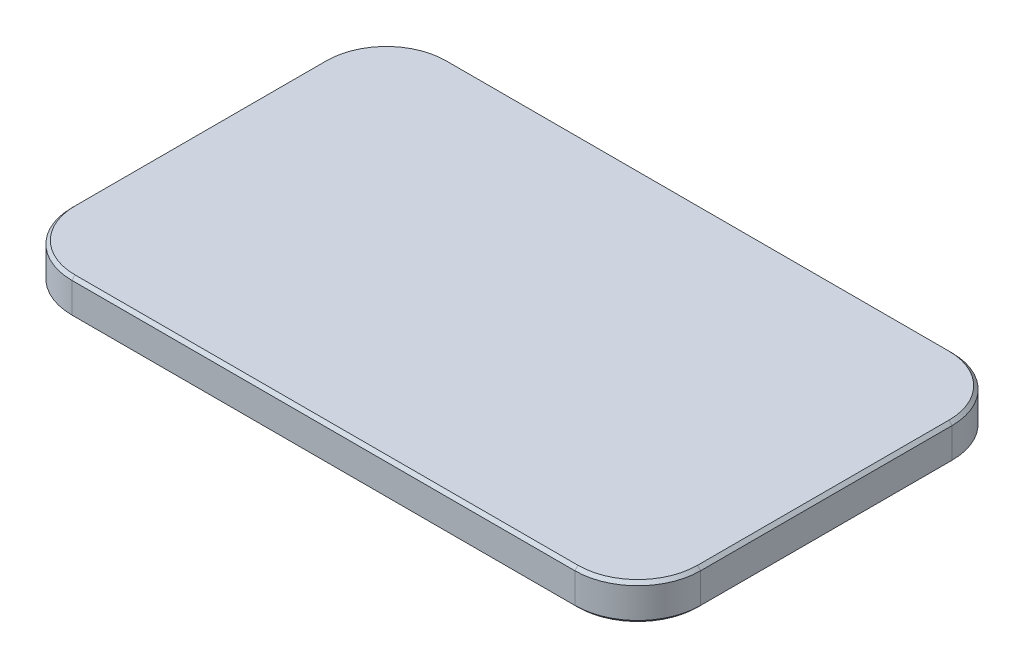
SolidWorks part; units mm, degrees
ref_plane "Plane1" through (0, 0, 0) normal (0, 0, 1) x (1, 0, 0)
ref_plane "Plane2" through (0, 0, 0) normal (0, 1, 0) x (1, 0, 0)
ref_plane "Plane3" through (0, 0, 0) normal (1, 0, 0) x (0, 0, -1)
sketch "Sketch1" plane through (0, 0, 0) normal (0, 1, 0) x (1, 0, 0)
  line L0 (-63.5, 38.1) -> (63.5, -38.1) construction
  line L1 (-63.5, 38.1) -> (63.5, 38.1)
  line L2 (-63.5, 38.1) -> (-63.5, -38.1)
  line L3 (-63.5, -38.1) -> (63.5, -38.1)
  line L4 (63.5, 38.1) -> (63.5, -38.1)
  dimension "D1" = 127
  dimension "D2" = 76.2
extrude "Extrude1" add sketch "Sketch1" along normal blind 7.3427
fillet "Fillet1" radius 12.7 4 edges at (-63.5, 3.6714, -38.1) (63.5, 3.6714, -38.1) (-63.5, 3.6714, 38.1) (63.5, 3.6714, 38.1)
chamfer "Chamfer1" distance 0.635 angle 45 16 edges at (0, 0, 38.1) (63.5, 0, 0) (0, 0, -38.1) (-63.5, 0, 0) (0, 7.3427, -38.1) (63.5, 7.3427, 0) (0, 7.3427, 38.1) (-63.5, 7.3427, 0) (-59.7803, 0, 34.3803) (59.7803, 0, 34.3803) (59.7803, 0, -34.3803) (-59.7803, 0, -34.3803) (59.7803, 7.3427, -34.3803) (59.7803, 7.3427, 34.3803) (-59.7803, 7.3427, 34.3803) (-59.7803, 7.3427, -34.3803)
